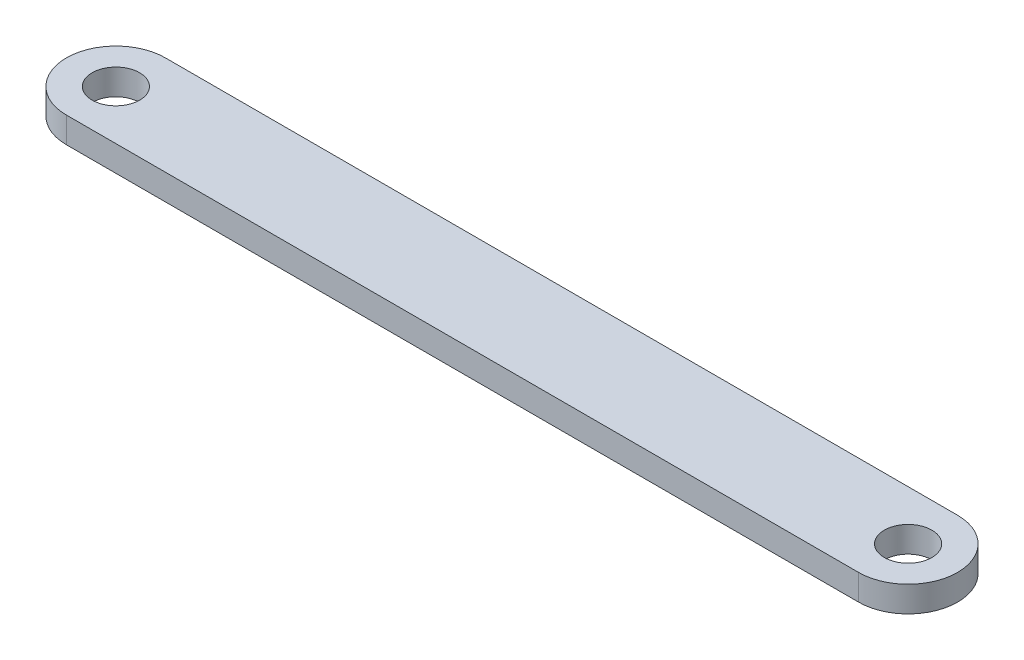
SolidWorks part; units mm, degrees
ref_plane "Front Plane" through (0, 0, 0) normal (0, 0, 1) x (1, 0, 0)
ref_plane "Top Plane" through (0, 0, 0) normal (0, 1, 0) x (1, 0, 0)
ref_plane "Right Plane" through (0, 0, 0) normal (1, 0, 0) x (0, 0, -1)
sketch "Sketch2" plane through (0, 0, 0) normal (0, 1, 0) x (1, 0, 0)
  line L0 (0, 0) -> (200, 0) construction
  line L1 (0, 12.5) -> (200, 12.5)
  line L2 (0, -12.5) -> (200, -12.5)
  arc A0 (0, 12.5) -> (0, -12.5) centre (0, 0) ccw
  arc A1 (200, -12.5) -> (200, 12.5) centre (200, 0) ccw
  circle A2 centre (0, 0) radius 6
  circle A3 centre (200, 0) radius 6
  point P3 (100, 0)
  dimension "D2" = 25
  dimension "D3" = 12
  dimension "D4" = 12
  dimension "D1" = 200
extrude "Boss-Extrude1" add sketch "Sketch2" along normal blind 6.5
